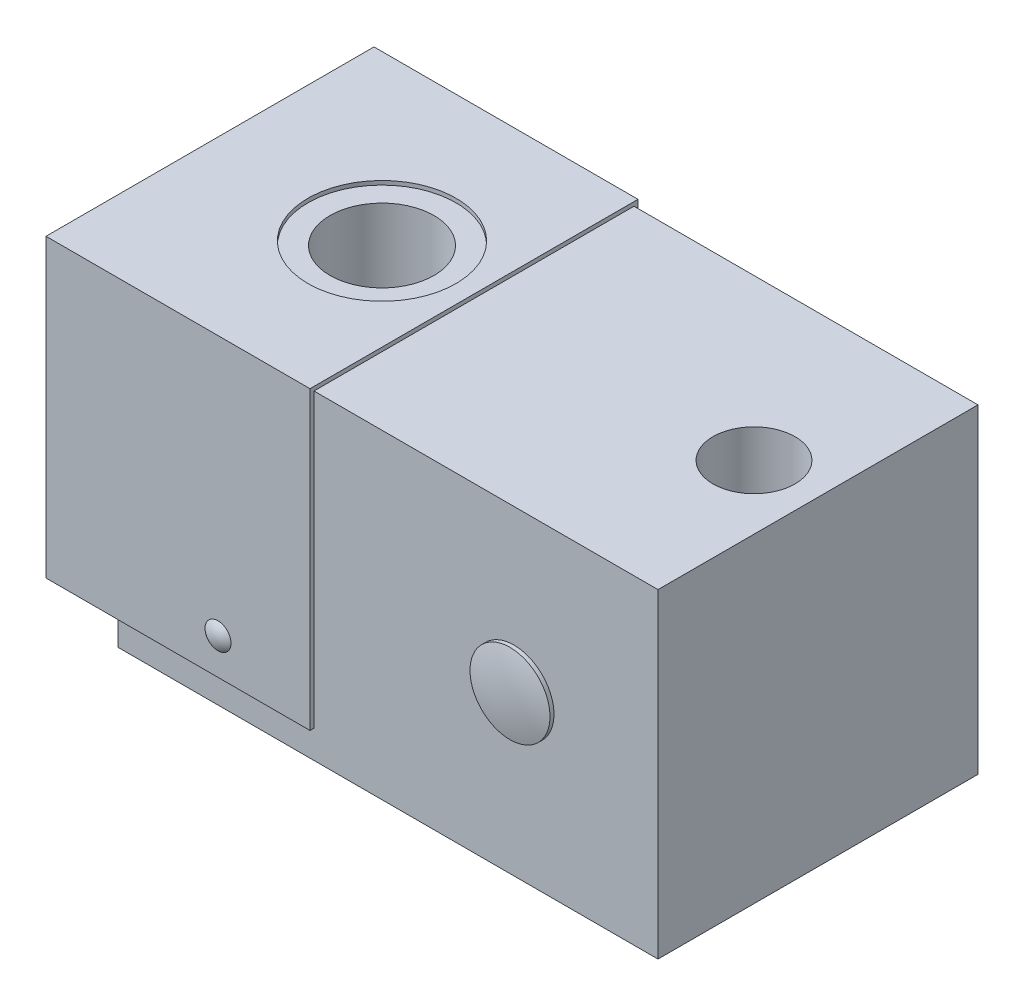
SolidWorks part; units mm, degrees
ref_plane "Front Plane" through (0, 0, 0) normal (0, 0, 1) x (1, 0, 0)
ref_plane "Top Plane" through (0, 0, 0) normal (0, 1, 0) x (1, 0, 0)
ref_plane "Right Plane" through (0, 0, 0) normal (1, 0, 0) x (0, 0, -1)
ref_plane "Plane1" through (0, 0, 0) normal (0, 1, 0) x (-1, 0, 0)
sketch "Sketch1" plane through (0, 0, 0) normal (0, 1, 0) x (-1, 0, 0)
  line L0 (66, 41) -> (0, 41)
  line L1 (0, 41) -> (0, 40)
  line L2 (0, 40) -> (-86, 40)
  line L3 (-86, 40) -> (-86, -40)
  line L4 (-86, -40) -> (0, -40)
  line L5 (0, -40) -> (0, -41)
  line L6 (0, -41) -> (66, -41)
  line L7 (66, -41) -> (66, 41)
extrude "Extrude1" add sketch "Sketch1" along normal blind 81
ref_plane "Plane2" through (0, 0, 0) normal (0, 0, 1) x (1, 0, 0)
sketch "Sketch2" plane through (0, 0, 0) normal (0, 0, 1) x (1, 0, 0)
  line L0 (0, 80) -> (86, 80)
  line L1 (86, 80) -> (86, 82)
  line L2 (86, 82) -> (0, 82)
  line L3 (0, 82) -> (0, 80)
extrude "Cut-Extrude1" cut sketch "Sketch2" against normal blind 40 and the other way blind 40
ref_plane "Plane3" through (0, 0, 0) normal (0, 0, 1) x (1, 0, 0)
sketch "Sketch3" plane through (0, 0, 0) normal (0, 0, 1) x (1, 0, 0)
  line L0 (-82, 80) -> (-82, 0)
  line L1 (-82, 0) -> (-49, 0)
  line L2 (-49, 0) -> (-49, 80)
  line L3 (-49, 80) -> (-82, 80)
extrude "Cut-Extrude2" cut sketch "Sketch3" against normal blind 40 and the other way blind 40
ref_plane "Plane4" through (0, 0, 0) normal (1, 0, 0) x (0, 0, -1)
sketch "Sketch4" plane through (0, 0, 0) normal (1, 0, 0) x (0, 0, -1)
  line L0 (40, 0) -> (42, 0)
  line L1 (42, 0) -> (42, 7)
  line L2 (42, 7) -> (40, 7)
  line L3 (40, 7) -> (40, 0)
extrude "Cut-Extrude3" cut sketch "Sketch4" against normal blind 66
ref_plane "Plane5" through (0, 0, 0) normal (1, 0, 0) x (0, 0, -1)
sketch "Sketch5" plane through (0, 0, 0) normal (1, 0, 0) x (0, 0, -1)
  line L0 (-42, 0) -> (-40, 0)
  line L1 (-40, 0) -> (-40, 7)
  line L2 (-40, 7) -> (-42, 7)
  line L3 (-42, 7) -> (-42, 0)
extrude "Cut-Extrude4" cut sketch "Sketch5" against normal blind 66
ref_plane "Plane6" through (0, 0, 0) normal (0, 0, 1) x (1, 0, 0)
sketch "Sketch6" plane through (0, 0, 0) normal (0, 0, 1) x (1, 0, 0)
  line L0 (-76, 40) -> (-76, 62)
  line L1 (-76, 62) -> (14, 62)
  line L2 (14, 62) -> (14, 60.25)
  line L3 (14, 60.25) -> (44, 60.25)
  line L4 (44, 60.25) -> (53.4427, 40)
  line L5 (53.4427, 40) -> (-76, 40)
  line L6 (53.4427, 40) -> (-76, 40) construction
revolve "Cut-Revolve1" cut sketch "Sketch6" angle 360 about L6
ref_plane "Plane7" through (0, 0, 0) normal (0, 0, 1) x (1, 0, 0)
sketch "Sketch7" plane through (0, 0, 0) normal (0, 0, 1) x (1, 0, 0)
  line L0 (70, 80) -> (80.25, 80)
  line L1 (80.25, 80) -> (80.25, 0)
  line L2 (80.25, 0) -> (70, 0)
  line L3 (70, 0) -> (70, 80)
  line L4 (70, 0) -> (70, 80) construction
revolve "Cut-Revolve2" cut sketch "Sketch7" angle 360 about L4
ref_plane "Plane8" through (0, 0, 30) normal (0, 0, 1) x (1, 0, 0)
sketch "Sketch8" plane through (0, 0, 30) normal (0, 0, 1) x (1, 0, 0)
  line L0 (70, 30.9174) -> (75.053, 28)
  line L1 (75.053, 28) -> (75.053, 0.947)
  line L2 (75.053, 0.947) -> (76, 0)
  line L3 (76, 0) -> (70, 0)
  line L4 (70, 0) -> (70, 30.9174)
  line L5 (70, 0) -> (70, 30.9174) construction
revolve "Cut-Revolve3" cut sketch "Sketch8" angle 360 about L5
ref_plane "Plane9" through (0, 0, 30) normal (0, 0, 1) x (1, 0, 0)
sketch "Sketch9" plane through (0, 0, 30) normal (0, 0, 1) x (1, 0, 0)
  line L0 (-34, 30.9174) -> (-28.947, 28)
  line L1 (-28.947, 28) -> (-28.947, 0.947)
  line L2 (-28.947, 0.947) -> (-28, 0)
  line L3 (-28, 0) -> (-34, 0)
  line L4 (-34, 0) -> (-34, 30.9174)
  line L5 (-34, 0) -> (-34, 30.9174) construction
revolve "Cut-Revolve4" cut sketch "Sketch9" angle 360 about L5
ref_plane "Plane10" through (0, 0, -30) normal (0, 0, 1) x (1, 0, 0)
sketch "Sketch10" plane through (0, 0, -30) normal (0, 0, 1) x (1, 0, 0)
  line L0 (70, 30.9174) -> (75.053, 28)
  line L1 (75.053, 28) -> (75.053, 0.947)
  line L2 (75.053, 0.947) -> (76, 0)
  line L3 (76, 0) -> (70, 0)
  line L4 (70, 0) -> (70, 30.9174)
  line L5 (70, 0) -> (70, 30.9174) construction
revolve "Cut-Revolve5" cut sketch "Sketch10" angle 360 about L5
ref_plane "Plane11" through (0, 0, -30) normal (0, 0, 1) x (1, 0, 0)
sketch "Sketch11" plane through (0, 0, -30) normal (0, 0, 1) x (1, 0, 0)
  line L0 (-34, 30.9174) -> (-28.947, 28)
  line L1 (-28.947, 28) -> (-28.947, 0.947)
  line L2 (-28.947, 0.947) -> (-28, 0)
  line L3 (-28, 0) -> (-34, 0)
  line L4 (-34, 0) -> (-34, 30.9174)
  line L5 (-34, 0) -> (-34, 30.9174) construction
revolve "Cut-Revolve6" cut sketch "Sketch11" angle 360 about L5
ref_plane "Plane12" through (0, 0, 0) normal (0, 0, 1) x (1, 0, 0)
sketch "Sketch12" plane through (0, 0, 0) normal (0, 0, 1) x (1, 0, 0)
  line L0 (-23, 81) -> (-4.5, 81)
  line L1 (-4.5, 81) -> (-4.5, 80)
  line L2 (-4.5, 80) -> (-10, 80)
  line L3 (-10, 80) -> (-10, 0)
  line L4 (-10, 0) -> (-23, 0)
  line L5 (-23, 0) -> (-23, 81)
  line L6 (-23, 0) -> (-23, 81) construction
revolve "Cut-Revolve7" cut sketch "Sketch12" angle 360 about L6
ref_plane "Plane13" through (50, 0, 0) normal (1, 0, 0) x (0, 0, -1)
sketch "Sketch13" plane through (50, 0, 0) normal (1, 0, 0) x (0, 0, -1)
  line L0 (40, 40) -> (40, 33.4215)
  line L1 (40, 33.4215) -> (39.144, 34.2775)
  line L2 (39.144, 34.2775) -> (-39.144, 34.2775)
  line L3 (-39.144, 34.2775) -> (-40, 33.4215)
  line L4 (-40, 33.4215) -> (-40, 40)
  line L5 (-40, 40) -> (40, 40)
  line L6 (-40, 40) -> (40, 40) construction
revolve "Cut-Revolve8" cut sketch "Sketch13" angle 360 about L6
ref_plane "Plane14" through (50, 0, 0) normal (1, 0, 0) x (0, 0, -1)
sketch "Sketch14" plane through (50, 0, 0) normal (1, 0, 0) x (0, 0, -1)
  line L0 (-30, 40) -> (-30, 34.2775)
  line L1 (-30, 34.2775) -> (-40, 34.2775)
  line L2 (-40, 34.2775) -> (-40, 30)
  line L3 (-40, 30) -> (-41, 30)
  line L4 (-42.2702, 40) -> (-30, 40)
  line L5 (-42.2702, 40) -> (-30, 40) construction
  arc A0 (-41, 30) -> (-42.2702, 40) centre (-2.2702, 40) cw
revolve "Revolve1" add sketch "Sketch14" angle 360 about L5
ref_plane "Plane15" through (50, 0, 0) normal (1, 0, 0) x (0, 0, -1)
sketch "Sketch15" plane through (50, 0, 0) normal (1, 0, 0) x (0, 0, -1)
  line L0 (42, 40) -> (42, 31)
  line L1 (42, 31) -> (40, 31)
  line L2 (40, 31) -> (40, 35.136)
  line L3 (40, 35.136) -> (30, 35.136)
  line L4 (30, 35.136) -> (30, 40)
  line L5 (30, 40) -> (42, 40)
  line L6 (30, 40) -> (42, 40) construction
revolve "Revolve2" add sketch "Sketch15" angle 360 about L6
ref_plane "Plane16" through (0, 0, -42) normal (0, 0, -1) x (-1, 0, 0)
sketch "Sketch16" plane through (0, 0, -42) normal (0, 0, -1) x (-1, 0, 0)
  line L0 (-47.9793, 43.5) -> (-52.0207, 43.5)
  line L1 (-52.0207, 43.5) -> (-54.0415, 40)
  line L2 (-54.0415, 40) -> (-52.0207, 36.5)
  line L3 (-52.0207, 36.5) -> (-47.9793, 36.5)
  line L4 (-47.9793, 36.5) -> (-45.9585, 40)
  line L5 (-45.9585, 40) -> (-47.9793, 43.5)
extrude "Cut-Extrude5" cut sketch "Sketch16" against normal blind 5
ref_plane "Plane17" through (-23, 0, 0) normal (1, 0, 0) x (0, 0, -1)
sketch "Sketch17" plane through (-23, 0, 0) normal (1, 0, 0) x (0, 0, -1)
  line L0 (-37.2, 21) -> (-37.2, 11)
  line L1 (-37.2, 21) -> (-37.2, 11) construction
  arc A0 (-37.2, 11) -> (-37.2, 21) centre (-37.2, 16) cw
revolve "Revolve3" add sketch "Sketch17" angle 90 about L1
ref_plane "Plane18" through (-23, 0, 0) normal (1, 0, 0) x (0, 0, -1)
sketch "Sketch18" plane through (-23, 0, 0) normal (1, 0, 0) x (0, 0, -1)
  line L0 (37.2, 11) -> (37.2, 21)
  line L1 (37.2, 11) -> (37.2, 21) construction
  arc A0 (37.2, 21) -> (37.2, 11) centre (37.2, 16) cw
revolve "Revolve4" add sketch "Sketch18" angle 90 about L1
ref_plane "Plane19" through (0, 0, 0) normal (0, 0, 1) x (1, 0, 0)
sketch "Sketch19" plane through (0, 0, 0) normal (0, 0, 1) x (1, 0, 0)
  line L0 (49, 40) -> (51.01, 40)
  line L1 (51.01, 40) -> (51.01, 2)
  line L2 (51.01, 2) -> (56, 2)
  line L3 (56, 2) -> (56, 0)
  line L4 (56, 0) -> (49, 0)
  line L5 (49, 0) -> (49, 40)
  line L6 (49, 0) -> (49, 40) construction
revolve "Cut-Revolve9" cut sketch "Sketch19" angle 360 about L6
ref_plane "Plane20" through (0, 2, 0) normal (0, -1, 0) x (1, 0, 0)
sketch "Sketch20" plane through (0, 2, 0) normal (0, -1, 0) x (1, 0, 0)
  circle A0 centre (49, 0) radius 4.55
extrude "Cut-Extrude6" cut sketch "Sketch20" against normal blind 4.5
ref_plane "Plane21" through (0, 0, 0) normal (0, 0, 1) x (1, 0, 0)
sketch "Sketch21" plane through (0, 0, 0) normal (0, 0, 1) x (1, 0, 0)
  line L0 (49, 16.5) -> (51, 16.5)
  line L1 (51, 16.5) -> (51.5, 16)
  line L2 (51.5, 16) -> (51.5, 6.5)
  line L3 (51.5, 6.5) -> (53.25, 6.5)
  line L4 (53.25, 6.5) -> (53.25, 2)
  line L5 (52.75, 1.5) -> (49, 1.5)
  line L6 (49, 1.5) -> (49, 16.5)
  line L7 (49, 1.5) -> (49, 16.5) construction
  arc A0 (53.25, 2) -> (52.75, 1.5) centre (52.75, 2) cw
revolve "Revolve5" add sketch "Sketch21" angle 360 about L7
ref_plane "Plane22" through (0, 1.5, 0) normal (0, -1, 0) x (1, 0, 0)
sketch "Sketch22" plane through (0, 1.5, 0) normal (0, -1, 0) x (1, 0, 0)
  line L0 (46.5, 1.4434) -> (46.5, -1.4434)
  line L1 (46.5, -1.4434) -> (49, -2.8868)
  line L2 (49, -2.8868) -> (51.5, -1.4434)
  line L3 (51.5, -1.4434) -> (51.5, 1.4434)
  line L4 (51.5, 1.4434) -> (49, 2.8868)
  line L5 (49, 2.8868) -> (46.5, 1.4434)
extrude "Cut-Extrude7" cut sketch "Sketch22" against normal blind 5
